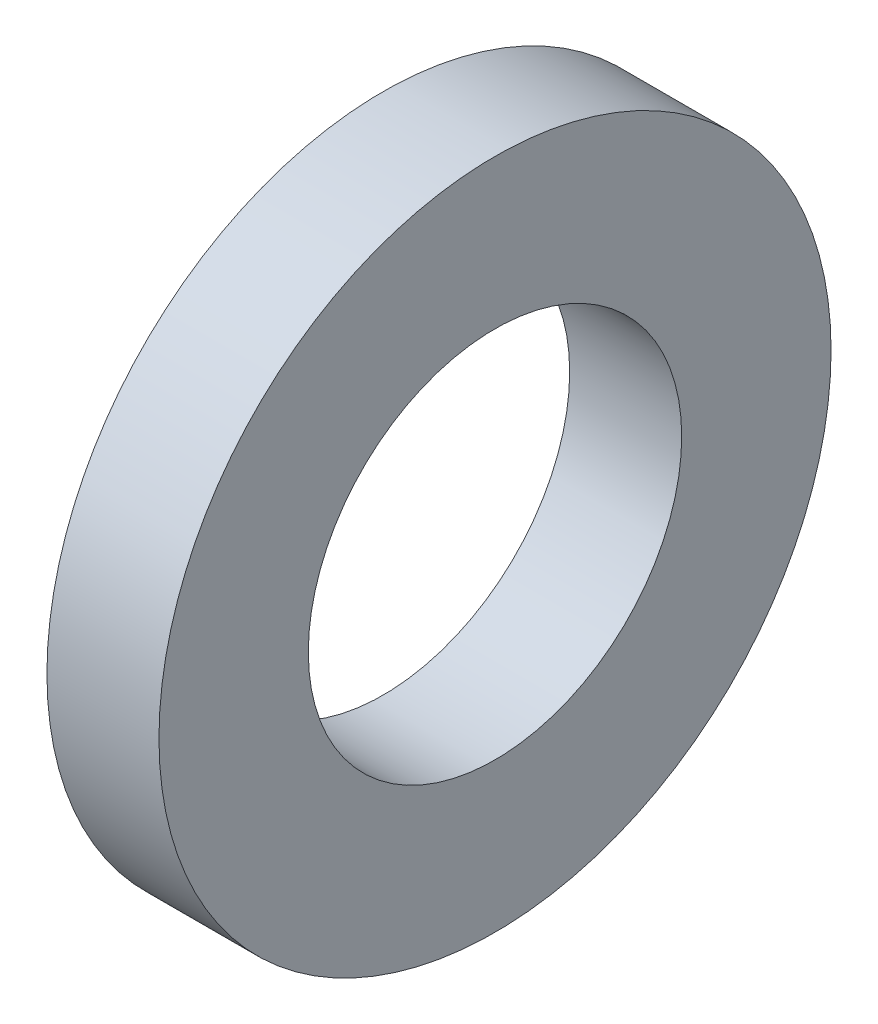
SolidWorks part; units mm, degrees
ref_plane "Face" through (0, 0, 0) normal (0, 0, 1) x (1, 0, 0)
ref_plane "Dessus" through (0, 0, 0) normal (0, 1, 0) x (1, 0, 0)
ref_plane "Droite" through (0, 0, 0) normal (1, 0, 0) x (0, 0, -1)
sketch "Esquisse1" plane through (0, 0, 0) normal (1, 0, 0) x (0, 0, -1)
  circle A0 centre (0, 0) radius 5
  circle A1 centre (0, 0) radius 9
  dimension "D1" = 10
  dimension "D2" = 18
extrude "Base-Extrusion" add sketch "Esquisse1" along normal blind 3
